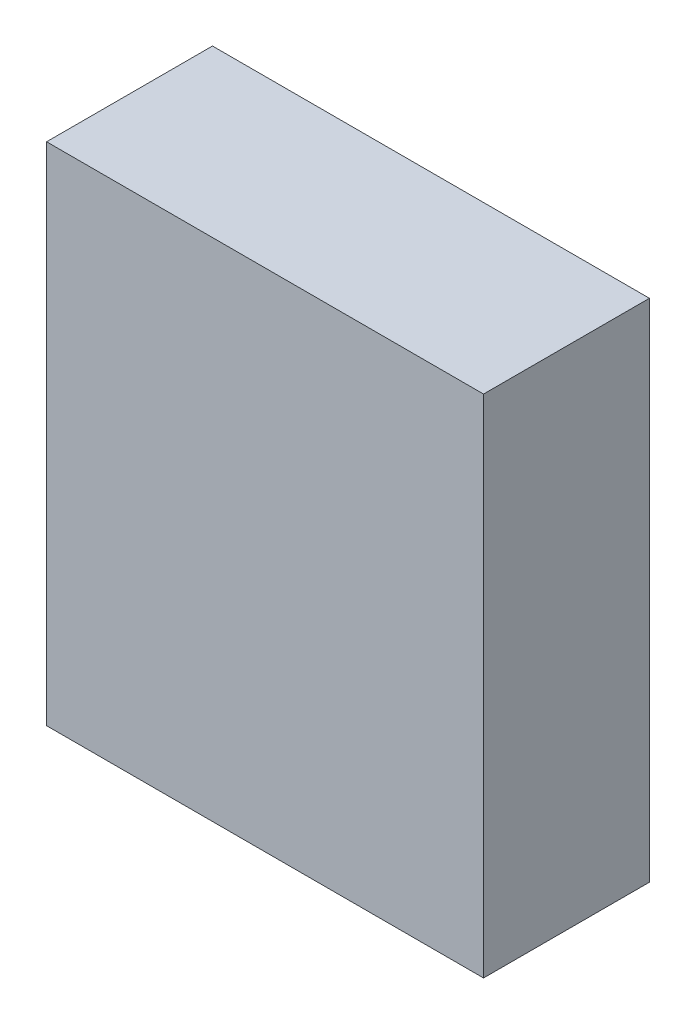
SolidWorks part; units mm, degrees
ref_plane "Alzado" through (0, 0, 0) normal (0, 0, 1) x (1, 0, 0)
ref_plane "Planta" through (0, 0, 0) normal (0, 1, 0) x (1, 0, 0)
ref_plane "Vista lateral" through (0, 0, 0) normal (1, 0, 0) x (0, 0, -1)
sketch "Croquis10" plane through (0, 0, 0) normal (0, 1, 0) x (1, 0, 0)
  line L0 (216, -82) -> (-216, 82) construction
  line L1 (216, 82) -> (-216, 82)
  line L2 (216, 82) -> (216, -82)
  line L3 (216, -82) -> (-216, -82)
  line L4 (-216, 82) -> (-216, -82)
  line L5 (-216, 82) -> (-215.5184, 81.6999) construction
  dimension "D1" = 164
  dimension "D2" = 432
extrude "Extruir9" add sketch "Croquis10" along normal blind 500
